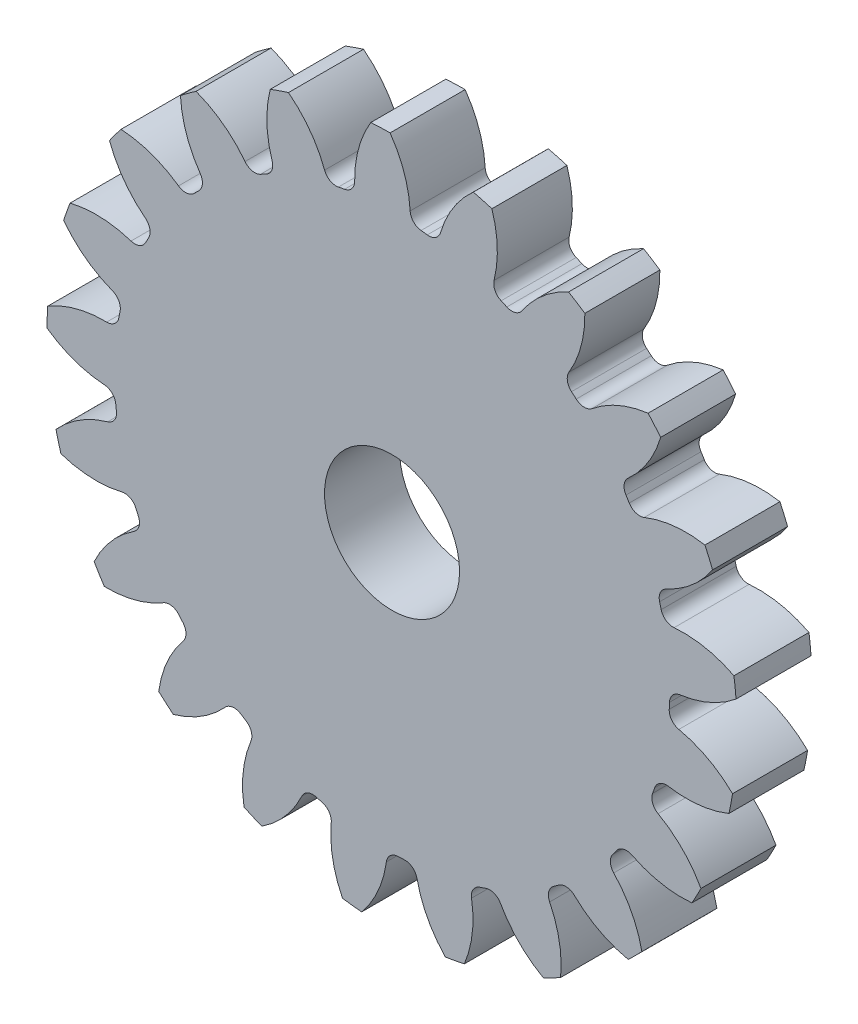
SolidWorks part; units mm, degrees
ref_plane "Front" through (0, 0, 0) normal (0, 0, 1) x (1, 0, 0)
ref_plane "Top" through (0, 0, 0) normal (0, 1, 0) x (1, 0, 0)
ref_plane "Right" through (0, 0, 0) normal (1, 0, 0) x (0, 0, -1)
sketch "Sketch3" plane through (0, 0, 0) normal (0, 0, 1) x (1, 0, 0)
  circle A0 centre (0, 0) radius 584.2
  dimension "od" = 1168.4
extrude "gearBody" add sketch "Sketch3" along normal blind 127
sketch "Sketch2" plane through (0, 0, 0) normal (0, 0, 1) x (1, 0, 0)
  line L0 (0, 0) -> (463.078, 191.8132) construction
  line L1 (578.2201, -96.4443) -> (0, 0) construction
  line L2 (0, 0) -> (36.3143, 0) construction
  line L3 (533.1058, 17.7127) -> (529.8344, -61.572) construction
  line L5 (531.4701, -21.9297) -> (0, 0) construction
  line L7 (0, 0) -> (501.232, 0) construction
  arc A0 (501.1672, 8.0631) -> (498.7993, -49.324) centre (0, 0) ccw construction
  arc A1 (582.3138, 46.9073) -> (576.4699, -94.7214) centre (0, 0) ccw construction
  arc A2 (533.1058, 17.7127) -> (529.8344, -61.572) centre (0, 0) ccw construction
  arc A3 (469.2536, -24.6382) -> (469.6883, -14.1047) centre (0, 0) ccw
  arc A4 (578.2201, -96.4443) -> (485.5143, -45.9272) centre (445.7015, -229.3115) ccw
  arc A5 (578.2201, -96.4443) -> (584.2, 48.4802) centre (0, 0) ccw
  arc A6 (584.2, 48.4802) -> (487.6475, 5.7723) centre (463.078, 191.8132) cw
  arc A7 (469.6883, -14.1047) -> (487.6475, 5.7723) centre (490.3545, -14.7253) cw
  arc A8 (485.5143, -45.9272) -> (469.2536, -24.6382) centre (489.9008, -25.7222) cw
  point P6 (584.2, 48.4802)
  point P22 (578.2201, -96.4443)
  dimension "baseDia" = 1002.4641
  dimension "od" = 1168.4
  dimension "pd" = 1066.8
  dimension "rd" = 939.8
  dimension "rFillet" = 20.6756
  dimension "pointX" = 584.2
  dimension "pointY" = 48.4802
  dimension "CTT" = 79.2847
  dimension "flankCenterAngle" = 22.5
extrude "toothCut" cut sketch "Sketch2" along normal through all
pattern_circular "CirPattern1" count 21 over 360 about axis through (0, 0, 0) along (0, 0, 1) of "toothCut"
sketch "hub1Dia" plane through (0, 0, 0) normal (0, 0, -1) x (-1, 0, 0)
  circle A0 centre (0, 0) radius 12.7
  dimension "hub1Dia" = 25.4
sketch "hub2Dia" plane through (0, 0, 127) normal (0, 0, 1) x (1, 0, 0)
  circle A0 centre (0, 0) radius 12.7
  dimension "hub2dia" = 25.4
sketch "boreDia" plane through (0, 0, 0) normal (0, 0, 1) x (1, 0, 0)
  circle A0 centre (0, 0) radius 114.3
  dimension "boreDia" = 228.6
extrude "bore" cut sketch "boreDia" against normal mid plane 25400
